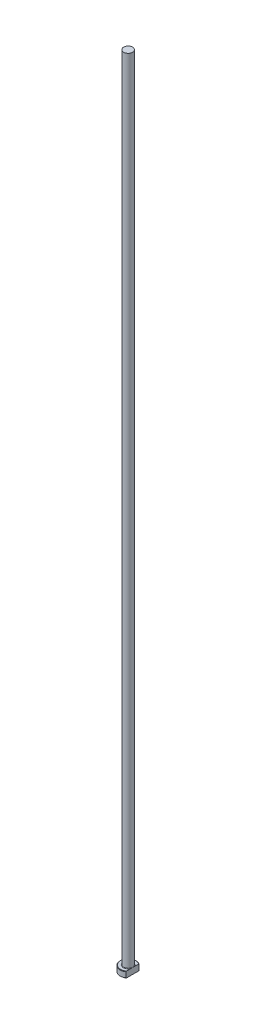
SolidWorks part; units mm, degrees
ref_plane "Front Plane" through (0, 0, 0) normal (0, 0, 1) x (1, 0, 0)
ref_plane "Top Plane" through (0, 0, 0) normal (0, 1, 0) x (1, 0, 0)
ref_plane "Right Plane" through (0, 0, 0) normal (1, 0, 0) x (0, 0, -1)
sketch "Sketch1" plane through (0, 0, 0) normal (0, 0, 1) x (1, 0, 0)
  line L0 (0, 259.9588) -> (0, -15.1925) construction
  line L1 (0, 0) -> (-4, 0)
  line L2 (-4, 0) -> (-4, 3)
  line L3 (-4, 3) -> (-2.25, 3)
  line L4 (-2.25, 3) -> (-2.25, 400)
  line L5 (-2.25, 400) -> (0, 400)
  line L6 (0, 400) -> (0, 0)
  dimension "L" = 400
  dimension "H" = 8
  dimension "T" = 3
  dimension "D" = 4.5
revolve "Revolve1" add sketch "Sketch1" angle 360 about L0
chamfer "Chamfer1" distance 0.2 angle 45 2 edges at (0, 3, 4) (0, 0, 4)
fillet "Fillet1" radius 0.2 1 edges at (0, 3, 2.25)
sketch "Sketch2" plane through (0, 0, 0) normal (0, 1, 0) x (1, 0, 0)
  line L0 (2.25, 3.3072) -> (2.25, -3.3072)
  circle A0 centre (0, 0) radius 4 construction
  arc A1 (2.25, -3.3072) -> (2.25, 3.3072) centre (0, 0) ccw
  circle A2 centre (0, 0) radius 2.25 construction
extrude "KEY" cut sketch "Sketch2" along normal through all
